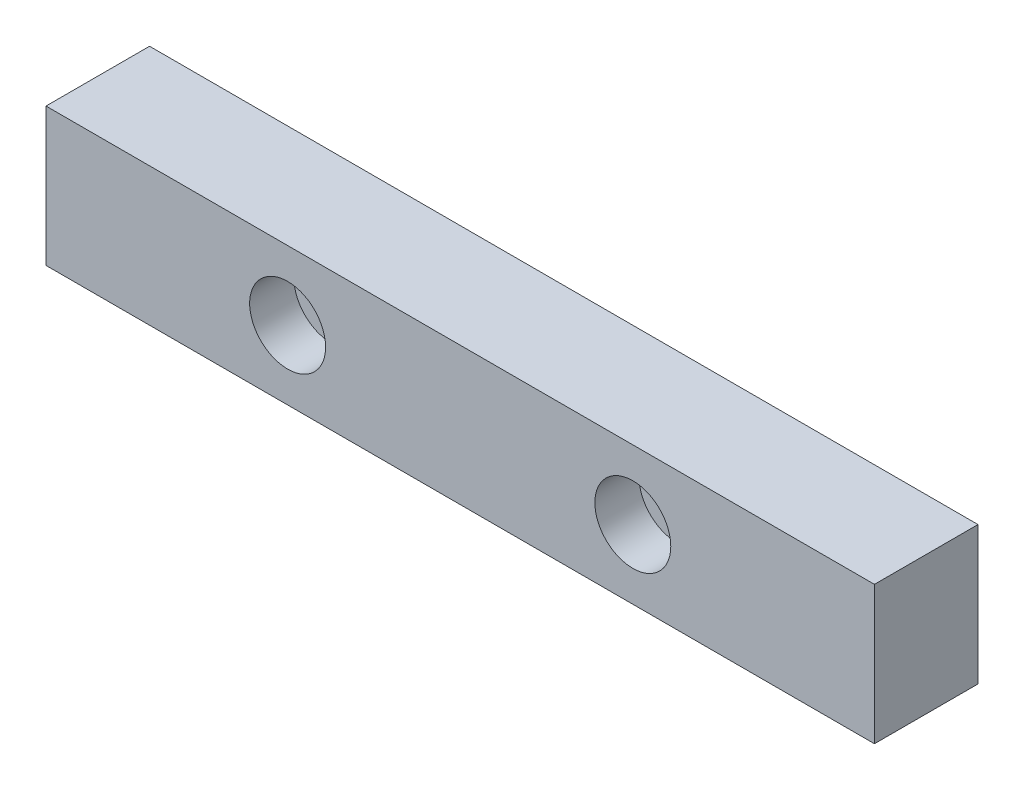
SolidWorks part; units mm, degrees
ref_plane "Plan de face" through (0, 0, 0) normal (0, 0, 1) x (1, 0, 0)
ref_plane "Plan de dessus" through (0, 0, 0) normal (0, 1, 0) x (1, 0, 0)
ref_plane "Plan de droite" through (0, 0, 0) normal (1, 0, 0) x (0, 0, -1)
sketch "Esquisse1" plane through (0, 0, 0) normal (0, 0, 1) x (1, 0, 0)
  line L1 (0, 0) -> (-120, 0)
  line L2 (0, 0) -> (0, 20)
  line L3 (0, 20) -> (-120, 20)
  line L4 (-120, 0) -> (-120, 20)
  dimension "D1" = 120
  dimension "D2" = 20
extrude "Boss.-Extru.1" add sketch "Esquisse1" along normal blind 15
hole_wizard "Chambrage pour vis à tête hexagonale M61" positions "Esquisse2" profile "Esquisse3" counterbore size "M6" standard "ISO"
sketch "Esquisse2" plane through (0, 0, 15) normal (0, 0, 1) x (1, 0, 0)
  line L1 (-120, 0) -> (0, 0) construction
  line L2 (0, 0) -> (0, 20) construction
  point P0 (-35, 10)
  point P2 (-85, 10)
  dimension "D1" = 50
  dimension "D2" = 35
  dimension "D3" = 10
sketch "Esquisse3" plane through (-35, 10, 15) normal (1, 0, 0) x (0, -1, 0)
  line L0 (0, 0) -> (0, 15)
  line L1 (0, 15) -> (3.3, 15)
  line L3 (3.3, 15) -> (3.3, 6.4)
  line L4 (3.3, 6.4) -> (5.5, 6.4)
  line L5 (5.5, 6.4) -> (5.5, 0)
  line L7 (5.5, 0) -> (0, 0)
  line L11 (0, -6.35) -> (0, 107.95) construction
  dimension "Diamètre du perçage jusqu'au prochain" = 6.6
  dimension "Profondeur du perçage jusqu'au prochain" = 15
  dimension "Diamètre du chambrage" = 11
  dimension "Profondeur du chambrage" = 6.4
